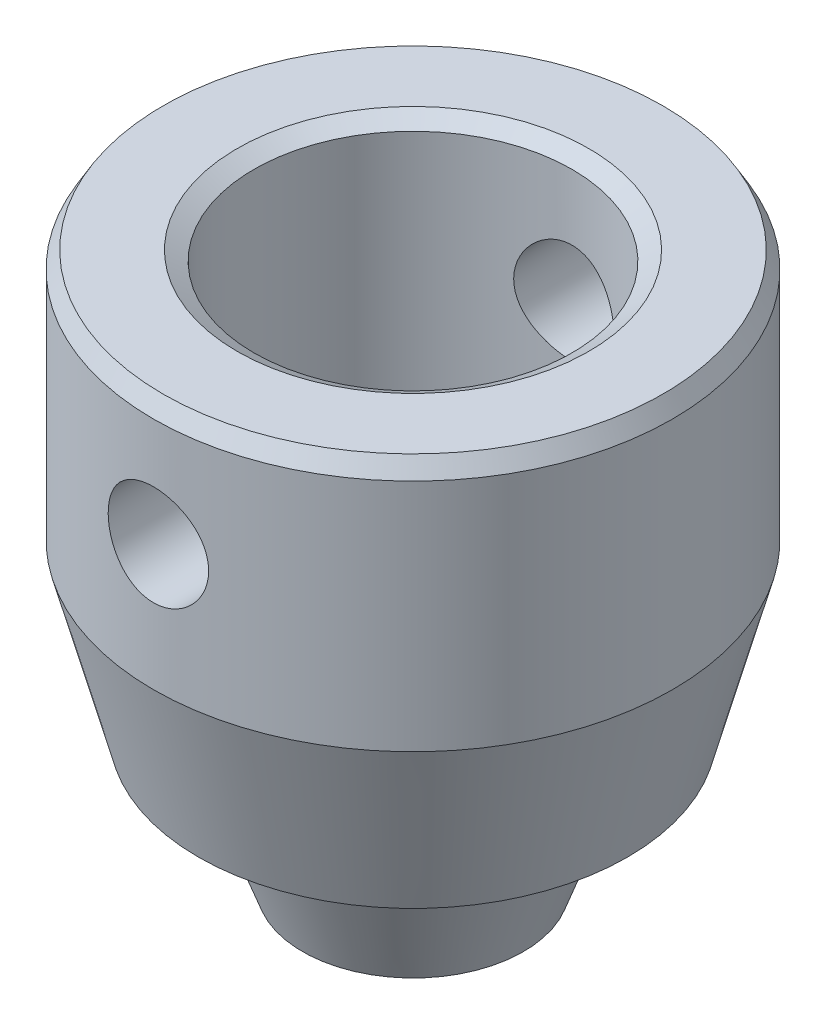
SolidWorks part; units mm, degrees
ref_plane "Face" through (0, 0, 0) normal (0, 0, 1) x (1, 0, 0)
ref_plane "Dessus" through (0, 0, 0) normal (0, 1, 0) x (1, 0, 0)
ref_plane "Profil" through (0, 0, 0) normal (1, 0, 0) x (0, 0, -1)
sketch "Esquisse1" plane through (0, 0, 0) normal (0, 1, 0) x (1, 0, 0)
  circle A0 centre (0, 0) radius 15.5
  dimension "D1" = 31
extrude "Base-Extrusion" add sketch "Esquisse1" along normal blind 25
chamfer "Chanfrein2" distance 10 angle 15
chamfer "Chanfrein3" distance 1 angle 30
sketch "Esquisse2" plane through (0, 25, 0) normal (0, 1, 0) x (-1, 0, 0)
  circle A0 centre (0, 0) radius 9.5
  circle A1 centre (0, 0) radius 14.9226 construction
  dimension "D1" = 19
extrude "Enlèv. mat.-Extru.1" cut sketch "Esquisse2" against normal blind 16
sketch "Esquisse5" plane through (0, 0, 0) normal (0, 0, 1) x (1, 0, 0)
  line L0 (0, 0) -> (0, 30.0768) construction
  line L1 (0, 24) -> (0, 10) construction
  line L2 (0, 0) -> (9.5118, 0)
  line L3 (-12.8205, 0) -> (12.8205, 0) construction
  line L5 (9.5118, 0) -> (6.6, -8)
  line L6 (6.6, -8) -> (0, -8)
  line L7 (0, 0) -> (0, -8)
  dimension "D1" = 20
  dimension "D2" = 8
  dimension "D3" = 6.6
revolve "Boss.-Révol.1" add sketch "Esquisse5" angle 360 about L0
chamfer "Chanfrein4" distance 1 angle 30
sketch "Esquisse6" plane through (0, 0, 0) normal (0, 0, 1) x (1, 0, 0)
  line L0 (0, 24) -> (0, 10) construction
  line L2 (14.9226, 25) -> (-14.9226, 25) construction
  circle A0 centre (0, 17.5) radius 3
  dimension "D1" = 6
  dimension "D3" = 7.5
extrude "Enlèv. mat.-Extru.3" cut sketch "Esquisse6" against normal through all and the other way through all
fillet "Congé1" radius 1
